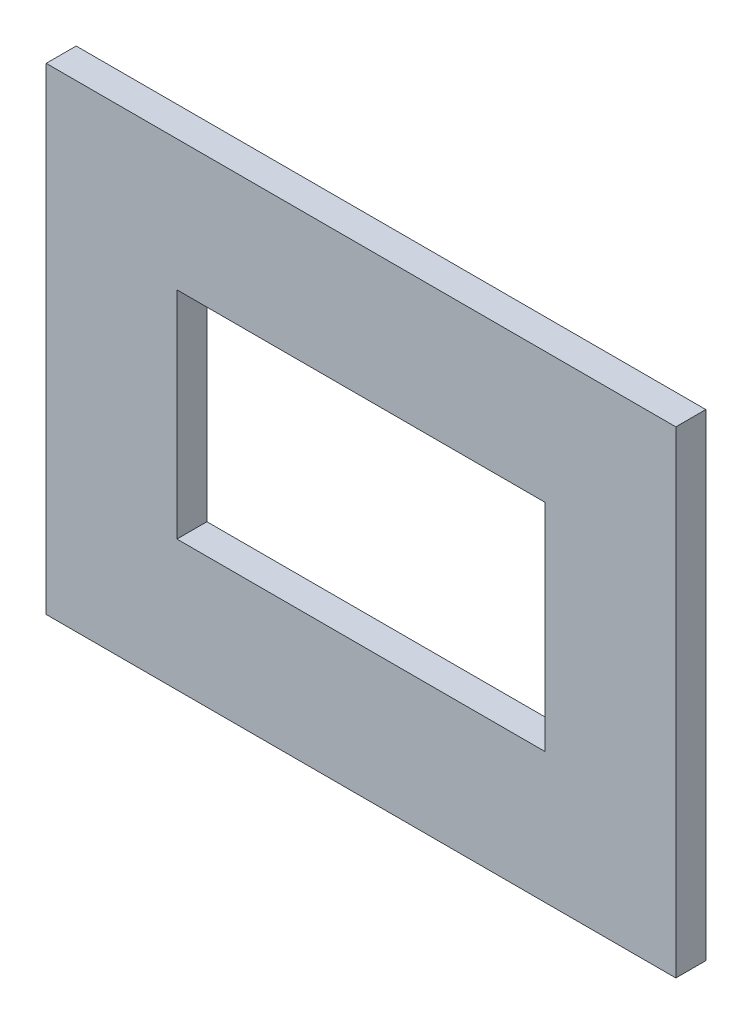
SolidWorks part; units mm, degrees
ref_plane "Front Plane" through (0, 0, 0) normal (0, 0, 1) x (1, 0, 0)
ref_plane "Top Plane" through (0, 0, 0) normal (0, 1, 0) x (1, 0, 0)
ref_plane "Right Plane" through (0, 0, 0) normal (1, 0, 0) x (0, 0, -1)
sketch "Sketch1" plane through (0, 0, 0) normal (0, 0, 1) x (1, 0, 0)
  line L1 (92.075, -53.975) -> (-92.075, -53.975)
  line L2 (92.075, -53.975) -> (92.075, 53.975)
  line L3 (92.075, 53.975) -> (-92.075, 53.975)
  line L4 (-92.075, -53.975) -> (-92.075, 53.975)
  line L5 (92.075, -53.975) -> (-92.075, 53.975) construction
  line L6 (92.075, 53.975) -> (-92.075, -53.975) construction
  line L7 (-639.1231, 371.2771) -> (768.3621, 371.2771)
  line L8 (-639.1231, 371.2771) -> (-639.1231, -757.682)
  line L9 (-639.1231, -757.682) -> (768.3621, -757.682)
  line L10 (768.3621, 371.2771) -> (768.3621, -757.682)
  point P0 (0, 0)
  dimension "D1" = 184.15
  dimension "D2" = 107.95
extrude "Boss-Extrude1" add sketch "Sketch1" along normal blind 15
sketch "Sketch2" plane through (0, 0, 0) normal (0, 0, -1) x (-1, 0, 0)
  line L1 (-834.5725, 454.6118) -> (800.2783, 454.6118)
  line L2 (-834.5725, 454.6118) -> (-834.5725, -959.418)
  line L3 (-834.5725, -959.418) -> (800.2783, -959.418)
  line L4 (800.2783, 454.6118) -> (800.2783, -959.418)
  line L5 (-189.0723, 163.765) -> (192.9837, 163.765)
  line L6 (-189.0723, 163.765) -> (-189.0723, -297.4311)
  line L7 (-189.0723, -297.4311) -> (192.9837, -297.4311)
  line L8 (192.9837, 163.765) -> (192.9837, -297.4311)
extrude "Cut-Extrude1" cut sketch "Sketch2" against normal through all
sketch "Sketch3" plane through (0, 0, 0) normal (0, 0, -1) x (-1, 0, 0)
  line L0 (-92.075, -53.975) -> (-92.075, 53.975) construction
  line L1 (92.1109, -53.9391) -> (-92.075, -53.9391) construction
  line L2 (92.1109, -53.9391) -> (92.1109, 53.975) construction
  line L3 (92.1109, 53.975) -> (-92.075, 53.975) construction
  line L4 (-92.075, -53.9391) -> (-92.075, 53.975) construction
  line L5 (92.1109, -53.9391) -> (-92.075, 53.975) construction
  line L6 (92.1109, 53.975) -> (-92.075, -53.9391) construction
  line L7 (-92.075, 53.975) -> (92.075, 53.975) construction
  line L8 (-189.0723, 163.765) -> (-189.0723, -297.4311) construction
  line L9 (157.475, -119.3391) -> (-157.4391, -119.3391)
  line L10 (157.475, -119.3391) -> (157.475, 119.375)
  line L11 (157.475, 119.375) -> (-157.4391, 119.375)
  line L12 (-157.4391, -119.3391) -> (-157.4391, 119.375)
  line L13 (157.475, -119.3391) -> (-157.4391, 119.375) construction
  line L14 (157.475, 119.375) -> (-157.4391, -119.3391) construction
  line L15 (-189.0723, 163.765) -> (192.9837, 163.765)
  line L16 (-189.0723, 163.765) -> (-189.0723, -297.4311)
  line L17 (-189.0723, -297.4311) -> (192.9837, -297.4311)
  line L18 (192.9837, 163.765) -> (192.9837, -297.4311)
  line L19 (192.9837, 163.765) -> (-189.0723, 163.765) construction
  line L20 (-189.0723, -297.4311) -> (192.9837, -297.4311) construction
  line L22 (-117.4391, 79.375) -> (117.475, 79.375)
  line L23 (-117.4391, 79.375) -> (-117.4391, -79.3391)
  line L24 (-117.4391, -79.3391) -> (117.475, -79.3391)
  line L25 (117.475, 79.375) -> (117.475, -79.3391)
  point P0 (0.018, 0.018)
  point P9 (0.018, 0.018)
  dimension "D1" = 40
  dimension "D2" = 40
  dimension "D3" = 40
  dimension "D4" = 40
extrude "Cut-Extrude2" cut sketch "Sketch3" against normal through all contours L9 L12 L11 L10 M8 M5 M6 M7
